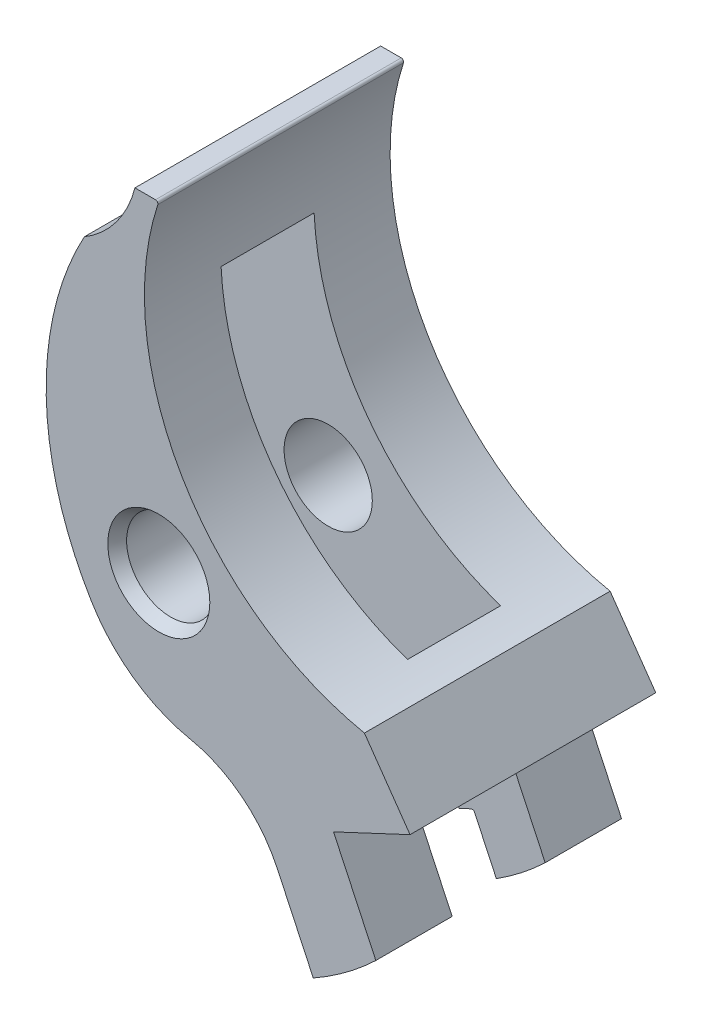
SolidWorks part; units mm, degrees
ref_plane "Front Plane" through (0, 0, 0) normal (0, 0, 1) x (1, 0, 0)
ref_plane "Top Plane" through (0, 0, 0) normal (0, 1, 0) x (1, 0, 0)
ref_plane "Right Plane" through (0, 0, 0) normal (1, 0, 0) x (0, 0, -1)
sketch "Sketch1" plane through (0, 0, 0) normal (0, 0, 1) x (1, 0, 0)
  line L0 (4.9337, -8.7361) -> (3.7889, -6.2921)
  line L1 (6.9318, -7.2533) -> (5.5811, -4.3698)
  line L2 (5.5811, -4.3698) -> (8.0254, -3.2247)
  line L3 (8.0254, -3.2247) -> (6.5675, -1.1426)
  line L4 (0, 10.2743) -> (-0.762, 10.2743)
  line L5 (0, 0) -> (50000, 0) construction
  line L6 (0, 0) -> (-45278.44, -21209.9711) construction
  line L7 (0, 0) -> (28678.8218, -40957.6022) construction
  line L8 (-11.1154, -5.5014) -> (45267.3245, 21204.4698) construction
  line L9 (0, 0) -> (9.3462, -19.952) construction
  circle A0 centre (0, 0) radius 1.4097
  arc A1 (4.9337, -8.7361) -> (6.9318, -7.2533) centre (0, 0) ccw
  arc A2 (6.5675, -1.1426) -> (0, 10.2743) centre (8.3282, 7.4676) cw
  arc A3 (-0.762, 10.2743) -> (-2.38, 8.1114) centre (-4.2051, 11.1633) cw
  arc A4 (-2.38, 8.1114) -> (-2.1434, -1.8733) centre (6.4085, 3.3245) ccw
  arc A5 (-2.1434, -1.8733) -> (1.0032, -4.0927) centre (1.9806, 0.6333) ccw
  arc A6 (1.0032, -4.0927) -> (3.7889, -6.2921) centre (0.2007, -7.973) cw
  dimension "D1" = 2.8194
  dimension "D2" = 10.033
  dimension "D3" = 10.0076
  dimension "D4" = 4.826
  dimension "D5" = 3.9624
  dimension "D6" = 3.556
  dimension "D20" = 8.7884
  dimension "D7" = 0.762
  dimension "D8" = 25.1
  dimension "D9" = 55
  dimension "D10" = 10.2743
  dimension "D11" = 0.762
  dimension "D12" = 11.1633
  dimension "D13" = 6.3246
  dimension "D14" = 4.7244
  dimension "D15" = 3.2004
  dimension "D16" = 0.2921
  dimension "D17" = 0.5588
  dimension "D18" = 7.4676
  dimension "D19" = 7.2136
extrude "Boss-Extrude1" add sketch "Sketch1" along normal mid plane 7.8486
sketch "Sketch2" plane through (0, 0, 0) normal (0, 0, 1) x (1, 0, 0)
  line L0 (6.1575, -4.0997) -> (5.9535, -3.8084)
  line L1 (5.5811, -4.3698) -> (8.0254, -3.2247) construction
  line L2 (8.0254, -3.2247) -> (6.5675, -1.1426) construction
  line L3 (0, 0) -> (-6.9722, 0) construction
  line L4 (0, 0) -> (-5.6002, -2.6233) construction
  line L5 (0, 0) -> (4.8003, -10.2476) construction
  line L6 (3.7889, -6.2921) -> (4.9337, -8.7361) construction
  line L7 (6.1575, -4.0997) -> (9.8045, -11.4682)
  line L8 (9.8045, -11.4682) -> (-5.6002, -19.0929)
  line L9 (-5.6002, -19.0929) -> (-12.3692, 4.116)
  line L10 (-12.3692, 4.116) -> (-5.6002, 10.7385)
  line L11 (-5.6002, 10.7385) -> (-2.435, 8.0091)
  arc A0 (5.9535, -3.8084) -> (-2.435, 8.0091) centre (-7.2457, -4.2917) ccw
  arc A1 (-2.38, 8.1114) -> (-2.1434, -1.8733) centre (6.4085, 3.3245) ccw construction
  dimension "D2" = 13.208
  dimension "D1" = 2.032
  dimension "D3" = 25.1
  dimension "D4" = 0.8128
  dimension "D5" = 8.382
extrude "Cut-Extrude1" cut sketch "Sketch2" against normal mid plane 2.9718
sketch "Sketch3" plane through (0, 0, 0) normal (1, 0, 0) x (0, 0, -1)
  line L0 (3.5433, 1.4097) -> (3.9243, 1.6297)
  line L1 (3.9243, -1.8733) -> (3.9243, 8.1114) construction
  line L2 (3.9243, 1.6297) -> (3.9243, 1.3442)
  line L4 (0, 0) -> (7.9944, 0) construction
  line L5 (3.9243, 1.3442) -> (3.4299, 1.3442)
  line L6 (3.4299, 1.3442) -> (3.5433, 1.4097)
  line L8 (0, 0) -> (0, 7.5971) construction
  line L9 (-3.4299, 1.3442) -> (-3.5433, 1.4097)
  line L10 (-3.9243, 1.3442) -> (-3.4299, 1.3442)
  line L11 (-3.9243, 1.6297) -> (-3.9243, 1.3442)
  line L12 (-3.5433, 1.4097) -> (-3.9243, 1.6297)
  dimension "D1" = 2.8194
  dimension "D2" = 30
  dimension "D3" = 0.381
revolve "Cut-Revolve1" cut sketch "Sketch3" angle 360 about L4
ref_plane "Plane1" through (4.2437, -9.0593, 0) normal (0.4242, -0.9056, 0) x (0.9056, 0.4242, 0)
sketch "Sketch4" plane through (4.2437, -9.0593, 0) normal (0.4242, -0.9056, 0) x (0.9056, 0.4242, 0)
  line L0 (0.762, 1.9939) -> (1.5002, 1.2557)
  line L1 (0.762, 3.9243) -> (0.762, 1.4859) construction
  line L2 (1.5508, -1.2051) -> (0.762, -1.9939)
  line L3 (0.762, -1.4859) -> (0.762, -3.9243) construction
  line L4 (1.5508, -1.2051) -> (0.5788, -1.2051)
  line L5 (2.5766, -1.4859) -> (1.1924, -1.4859) construction
  line L6 (0.762, 1.4859) -> (3.2004, 1.4859) construction
  line L7 (0.5788, -1.2051) -> (0.5788, -1.9939)
  line L8 (0.5788, -1.9939) -> (0.762, -1.9939)
  line L9 (1.5002, 1.2557) -> (0.5305, 1.2557)
  line L10 (0.5305, 1.2557) -> (0.5305, 1.9939)
  line L11 (0.5305, 1.9939) -> (0.762, 1.9939)
  point P10 (1.27, 1.4859)
  point P13 (1.27, -1.4859)
  dimension "D1" = 0.508
  dimension "D2" = 0.508
  dimension "D3" = 45
extrude "Cut-Extrude2" cut sketch "Sketch4" against normal blind 1.778
fillet "Fillet1" radius 0.0762 1 edges at (0, 10.2743, 0)
fillet "Fillet2" radius 0.0762 2 edges at (4.4095, -7.0182, 1.7399) (4.4095, -7.0182, -1.7399)
